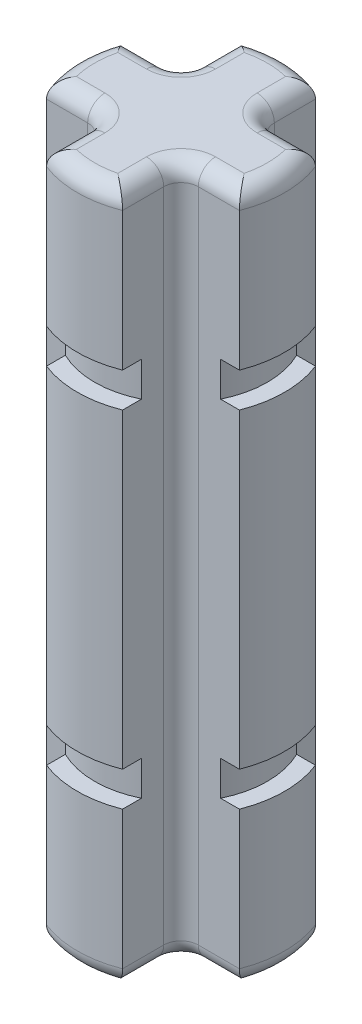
SolidWorks part; units mm, degrees
ref_plane "Front Plane" through (0, 0, 0) normal (0, 0, 1) x (1, 0, 0)
ref_plane "Top Plane" through (0, 0, 0) normal (0, 1, 0) x (1, 0, 0)
ref_plane "Right Plane" through (0, 0, 0) normal (1, 0, 0) x (0, 0, -1)
sketch "Sketch1" plane through (0, 0, 0) normal (0, 1, 0) x (1, 0, 0)
  line L8 (-2.2328, 0.88) -> (-0.88, 0.88)
  line L9 (2.2328, -0.88) -> (0.88, -0.88)
  line L10 (-0.88, 2.2328) -> (-0.88, 0.88)
  line L11 (-0.88, -0.88) -> (-0.88, -2.2328)
  line L12 (0.88, -2.2328) -> (0.88, -0.88)
  line L13 (0.88, 0.88) -> (2.2328, 0.88)
  line L14 (0.88, 0.88) -> (0.88, 2.2328)
  line L15 (-0.88, -0.88) -> (-2.2328, -0.88)
  arc A4 (2.2328, -0.88) -> (2.2328, 0.88) centre (0, 0) ccw
  arc A5 (0.88, 2.2328) -> (-0.88, 2.2328) centre (0, 0) ccw
  arc A6 (-2.2328, 0.88) -> (-2.2328, -0.88) centre (0, 0) ccw
  arc A7 (-0.88, -2.2328) -> (0.88, -2.2328) centre (0, 0) ccw
  dimension "D1" = 0.88
  dimension "D2" = 1.76
  dimension "D3" = 0.88
  dimension "D4" = 1.76
extrude "Boss-Extrude1" add sketch "Sketch1" along normal blind 16
fillet "Fillet7" radius 0.4 28 edges at (-1.5564, 0, -0.88) (-2.4, 0, 0) (-1.5564, 0, 0.88) (-0.88, 0, 1.5564) (0, 0, 2.4) (0.88, 0, 1.5564) (1.5564, 0, 0.88) (2.4, 0, 0) (1.5564, 0, -0.88) (0.88, 0, -1.5564) (0, 0, -2.4) (-0.88, 0, -1.5564) (0, 16, -2.4) (0.88, 16, -1.5564) (1.5564, 16, -0.88) (2.4, 16, 0) (1.5564, 16, 0.88) (0.88, 16, 1.5564) (0, 16, 2.4) (-0.88, 16, 1.5564) (-1.5564, 16, 0.88) (-2.4, 16, 0) (-1.5564, 16, -0.88) (-0.88, 16, -1.5564) (-0.88, 8, -0.88) (0.88, 8, 0.88) (-0.88, 8, 0.88) (0.88, 8, -0.88)
ref_plane "Plane1" through (0, 12, 0) normal (0, 1, 0) x (1, 0, 0)
ref_plane "Plane2" through (0, 4, 0) normal (0, -1, 0) x (-1, 0, 0)
sketch "Sketch11" plane through (0, 12, 0) normal (0, 1, 0) x (1, 0, 0)
  circle A0 centre (0, 0) radius 2.4
  circle A1 centre (0, 0) radius 2
extrude "Cut-Extrude1" cut sketch "Sketch11" against normal blind 0.4 and the other way blind 0.4
sketch "Sketch12" plane through (0, 4, 0) normal (0, -1, 0) x (-1, 0, 0)
  circle A0 centre (0, 0) radius 2.4
  circle A1 centre (0, 0) radius 2
extrude "Cut-Extrude2" cut sketch "Sketch12" against normal blind 0.4 and the other way blind 0.4
